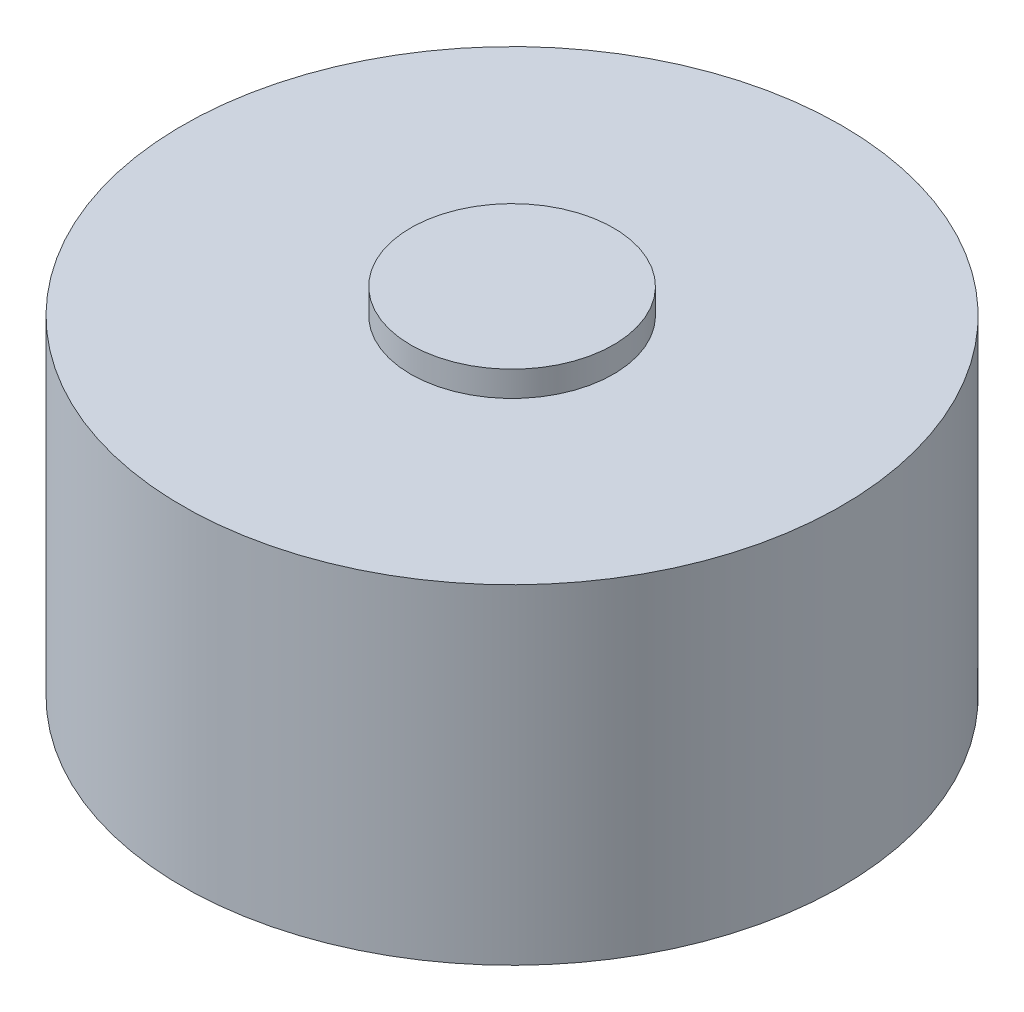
SolidWorks part; units mm, degrees
ref_plane "Front" through (0, 0, 0) normal (0, 0, 1) x (1, 0, 0)
ref_plane "Top" through (0, 0, 0) normal (0, 1, 0) x (1, 0, 0)
ref_plane "Right" through (0, 0, 0) normal (1, 0, 0) x (0, 0, -1)
sketch "Sketch1" plane through (0, 0, 0) normal (0, 1, 0) x (1, 0, 0)
  circle A0 centre (0, 0) radius 6.5
  dimension "D1" = 13
extrude "Boss-Extrude1" add sketch "Sketch1" along normal blind 6.5
sketch "Sketch2" plane through (0, 6.5, 0) normal (0, 1, 0) x (1, 0, 0)
  circle A0 centre (0, 0) radius 2
  dimension "D1" = 4
extrude "Boss-Extrude2" add sketch "Sketch2" along normal blind 0.5
